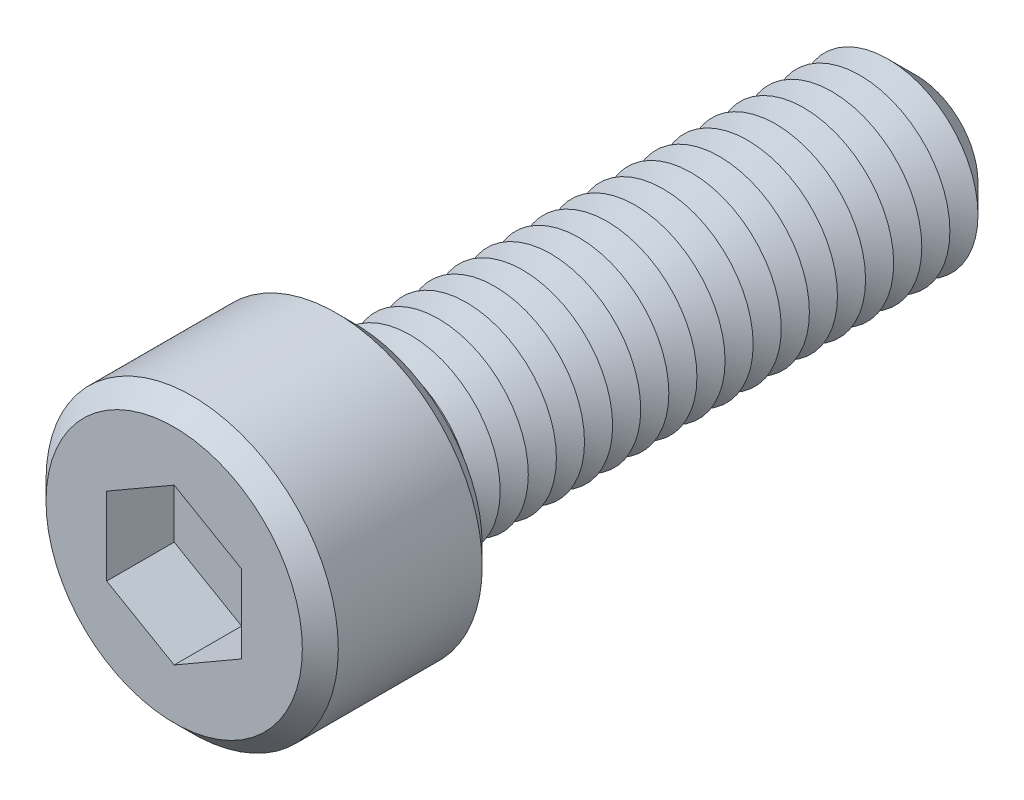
SolidWorks part; units mm, degrees
ref_plane "Front Plane" through (0, 0, 0) normal (0, 0, 1) x (1, 0, 0)
ref_plane "Top Plane" through (0, 0, 0) normal (0, 1, 0) x (1, 0, 0)
ref_plane "Right Plane" through (0, 0, 0) normal (1, 0, 0) x (0, 0, -1)
sketch "Sketch1" plane through (0, 0, 0) normal (0, 0, 1) x (1, 0, 0)
  circle A0 centre (0, 0) radius 6.5
  dimension "D1" = 13
extrude "Boss-Extrude1" add sketch "Sketch1" along normal blind 8
sketch "Sketch2" plane through (0, 0, 0) normal (0, 0, -1) x (-1, 0, 0)
  circle A0 centre (0, 0) radius 4
  dimension "D1" = 8
extrude "Boss-Extrude2" add sketch "Sketch2" along normal blind 25
chamfer "Chamfer1" distance 1.25 angle 45 1 edges at (-4, 0, -25)
sketch "Sketch3" plane through (0, 0, 0) normal (1, 0, 0) x (0, 0, -1)
  line L0 (-2.5121, 0) -> (4.5776, 0) construction
sketch "Sketch4" plane through (0, 0, 0) normal (1, 0, 0) x (0, 0, -1)
  line L0 (0, 4) -> (0.625, 2.9175)
  line L1 (0.625, 2.9175) -> (1.25, 4)
  line L2 (23.75, 4) -> (0, 4) construction
  line L3 (1.25, 4) -> (0, 4)
  dimension "D1" = 1.25
revolve "Cut-Revolve1" cut sketch "Sketch4" angle 360 about L0
pattern_linear "LPattern1" count 19 spacing 1.25 along (0, 0, -1) of "Cut-Revolve1"
sketch "Sketch5" plane through (0, 0, 8) normal (0, 0, 1) x (1, 0, 0)
  line L1 (0, 3.4641) -> (-3, 1.7321)
  line L2 (-3, 1.7321) -> (-3, -1.7321)
  line L3 (-3, -1.7321) -> (0, -3.4641)
  line L4 (0, -3.4641) -> (3, -1.7321)
  line L5 (3, -1.7321) -> (3, 1.7321)
  line L6 (3, 1.7321) -> (0, 3.4641)
  circle A0 centre (0, 0) radius 3 construction
  dimension "D1" = 6
extrude "Cut-Extrude1" cut sketch "Sketch5" against normal blind 3
sketch "Sketch6" plane through (0, 0, 5) normal (0, 0, 1) x (1, 0, 0)
  circle A0 centre (0, 0) radius 0.9
  dimension "D1" = 1.8
extrude "Cut-Extrude2" cut sketch "Sketch6" against normal up to surface (30 mm away)
chamfer "Chamfer2" distance 0.8 angle 45 2 edges at (6.5, 0, 0) (6.5, 0, 8)
